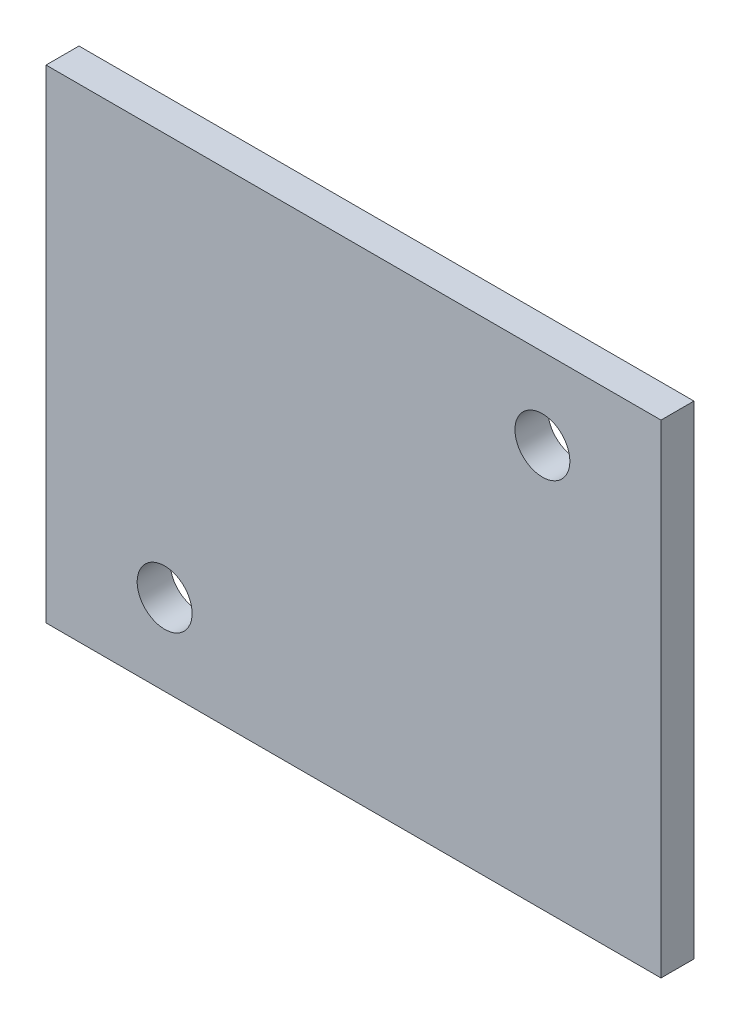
SolidWorks part; units mm, degrees
ref_plane "Plan de face" through (0, 0, 0) normal (0, 0, 1) x (1, 0, 0)
ref_plane "Plan de dessus" through (0, 0, 0) normal (0, 1, 0) x (1, 0, 0)
ref_plane "Plan de droite" through (0, 0, 0) normal (1, 0, 0) x (0, 0, -1)
sketch "Esquisse1" plane through (0, 0, 0) normal (0, 0, 1) x (1, 0, 0)
  line L1 (-14, 11) -> (14, 11)
  line L2 (-14, 11) -> (-14, -11)
  line L3 (-14, -11) -> (14, -11)
  line L4 (14, 11) -> (14, -11)
  circle A0 centre (-8.6, -7.3) radius 1.25
  circle A1 centre (8.6, 7.3) radius 1.25
  dimension "D5" = 2.5
  dimension "D6" = 2.5
  dimension "D1" = 28
  dimension "D2" = 22
  dimension "D3" = 14
  dimension "D4" = 11
  dimension "D7" = 7.3
  dimension "D8" = 8.6
  dimension "D9" = 8.6
  dimension "D10" = 7.3
extrude "Extrusion1" add sketch "Esquisse1" along normal blind 1.5
